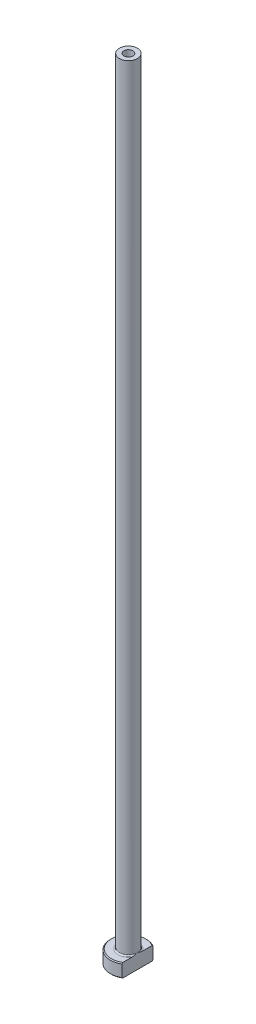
SolidWorks part; units mm, degrees
ref_plane "Front Plane" through (0, 0, 0) normal (0, 0, 1) x (1, 0, 0)
ref_plane "Top Plane" through (0, 0, 0) normal (0, 1, 0) x (1, 0, 0)
ref_plane "Right Plane" through (0, 0, 0) normal (1, 0, 0) x (0, 0, -1)
sketch "Sketch1" plane through (0, 0, 0) normal (0, 0, 1) x (1, 0, 0)
  line L0 (-1, 175) -> (-2, 175)
  line L1 (-2, 175) -> (-2, 3)
  line L2 (-2, 3) -> (-4, 3)
  line L3 (-4, 3) -> (-4, 0)
  line L4 (3.3, 0) -> (-3.3, 0) construction
  line L5 (-4, 0) -> (-1.25, 0)
  line L6 (-1, 140) -> (-1, 175)
  line L7 (0, 92.1877) -> (0, -15.5353) construction
  line L8 (0, -4.4) -> (0, 4.4) construction
  line L9 (-1, 140) -> (-1.25, 128)
  line L10 (-1.25, 128) -> (-1.25, 0)
  dimension "D1" = 0.25
  dimension "ID" = 2
  dimension "OD" = 4
  dimension "L" = 175
  dimension "H" = 8
  dimension "T" = 3
  dimension "N" = 35
  dimension "D2" = 12
  dimension "L-N" = 140
revolve "Revolve1" add sketch "Sketch1" angle 360 about L7
fillet "Fillet1" radius 0.3 1 edges at (0, 3, 2)
chamfer "Chamfer1" distance 0.2 angle 45 2 edges at (0, 3, 4) (0, 0, 4)
sketch "Sketch2" plane through (0, 0, 0) normal (0, -1, 0) x (1, 0, 0)
  line L0 (2, 3.4641) -> (2, -3.4641)
  circle A0 centre (0, 0) radius 4 construction
  arc A1 (2, 3.4641) -> (2, -3.4641) centre (0, 0) cw
  circle A2 centre (0, 0) radius 2 construction
extrude "Cut-Extrude1" cut sketch "Sketch2" against normal through all
chamfer "Chamfer2" distance 0.5 angle 45 1 edges at (0, 0, 1.25)
